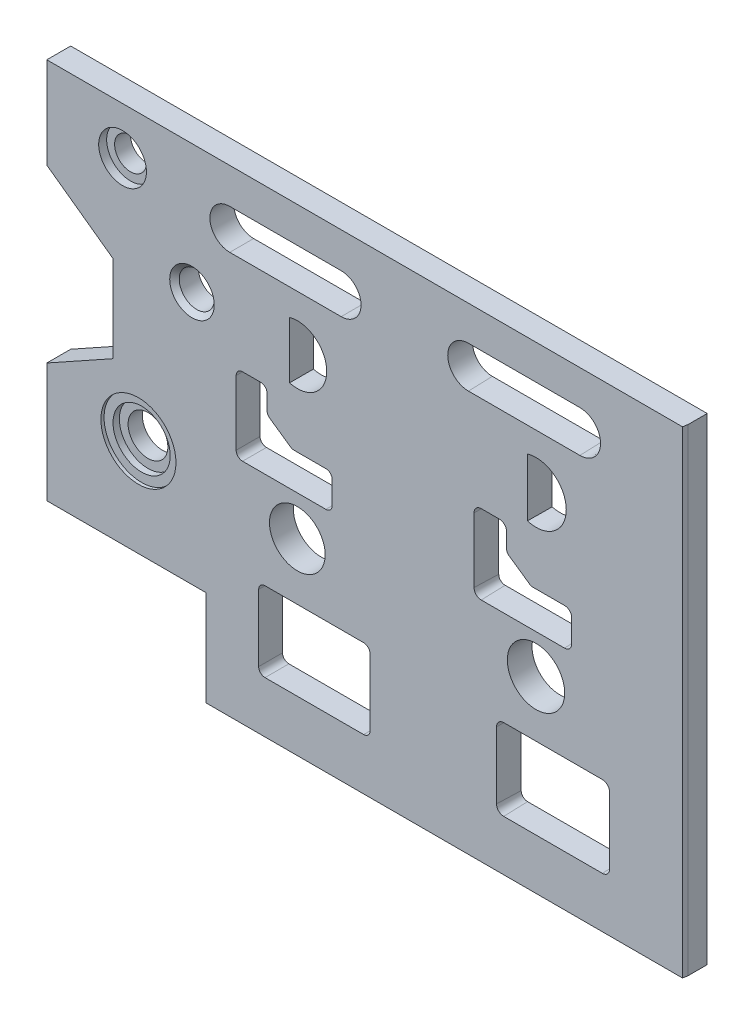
SolidWorks part; units mm, degrees
ref_plane "Front" through (0, 0, 0) normal (0, 0, 1) x (1, 0, 0)
ref_plane "Top" through (0, 0, 0) normal (0, 1, 0) x (1, 0, 0)
ref_plane "Right" through (0, 0, 0) normal (1, 0, 0) x (0, 0, -1)
sketch "Sketch1" plane through (0, 0, 0) normal (0, 0, 1) x (1, 0, 0)
  line L1 (0, 0) -> (400, 0)
  line L2 (0, 0) -> (0, 300)
  line L3 (0, 300) -> (400, 300)
  line L4 (400, 0) -> (400, 300)
  dimension "D1" = 400
  dimension "D2" = 300
extrude "Base-Extrude" add sketch "Sketch1" along normal blind 15
sketch "Sketch3" plane through (0, 0, 0) normal (0, 0, -1) x (-1, 0, 0)
  line L0 (0, 134.9765) -> (-41.6275, 158.1377)
  line L1 (0, 0) -> (-100, 0)
  line L3 (0, 60) -> (-100, 60)
  line L4 (-100, 0) -> (-100, 60)
  line L5 (0, 300) -> (0, 0) construction
  line L6 (-41.6275, 158.1377) -> (-41.6275, 212.5978)
  line L7 (-41.6275, 212.5978) -> (0, 242.6448)
  line L8 (0, 242.6448) -> (0, 134.9765)
  line L9 (0, 60) -> (0, 0)
  dimension "D1" = 100
  dimension "D2" = 60
extrude "Cut-Extrude1" cut sketch "Sketch3" against normal blind 15
sketch "Sketch5" plane through (0, 0, 0) normal (0, 0, -1) x (-1, 0, 0)
  line L0 (-119.0047, 187.7042) -> (-119.0047, 147.0156)
  line L1 (-137.1299, 82.3161) -> (-199.1299, 82.3161)
  line L2 (-133.1299, 78.3161) -> (-133.1299, 36.3161)
  line L3 (-137.1299, 32.3161) -> (-199.1299, 32.3161)
  line L4 (-203.1299, 78.3161) -> (-203.1299, 36.3161)
  line L5 (-123.0047, 143.0156) -> (-175.3427, 143.0156)
  line L6 (-179.3427, 147.0156) -> (-179.3427, 161.169)
  line L7 (-175.3427, 165.169) -> (-155.4347, 165.169)
  line L8 (-153.1505, 165.8854) -> (-140.1258, 174.9461)
  line L9 (-138.41, 178.2297) -> (-138.41, 187.7042)
  line L10 (-134.41, 191.7042) -> (-123.0047, 191.7042)
  line L11 (-152.5477, 236.0895) -> (-152.5477, 200.4363)
  line L13 (-114.9765, 277.6995) -> (-184.9765, 277.6995)
  line L15 (-114.9765, 252.6995) -> (-184.9765, 252.6995)
  circle A0 centre (-157.4347, 118.0751) radius 17.5
  arc A1 (-119.0047, 187.7042) -> (-123.0047, 191.7042) centre (-123.0047, 187.7042) ccw
  arc A2 (-119.0047, 147.0156) -> (-123.0047, 143.0156) centre (-123.0047, 147.0156) cw
  arc A3 (-140.1258, 174.9461) -> (-138.41, 178.2297) centre (-142.41, 178.2297) ccw
  arc A4 (-138.41, 187.7042) -> (-134.41, 191.7042) centre (-134.41, 187.7042) cw
  arc A5 (-155.4347, 165.169) -> (-153.1505, 165.8854) centre (-155.4347, 169.169) ccw
  arc A6 (-179.3427, 161.169) -> (-175.3427, 165.169) centre (-175.3427, 161.169) cw
  arc A7 (-175.3427, 143.0156) -> (-179.3427, 147.0156) centre (-175.3427, 147.0156) cw
  arc A8 (-137.1299, 82.3161) -> (-133.1299, 78.3161) centre (-137.1299, 78.3161) cw
  arc A9 (-133.1299, 36.3161) -> (-137.1299, 32.3161) centre (-137.1299, 36.3161) cw
  arc A10 (-199.1299, 32.3161) -> (-203.1299, 36.3161) centre (-199.1299, 36.3161) cw
  arc A11 (-199.1299, 82.3161) -> (-203.1299, 78.3161) centre (-199.1299, 78.3161) ccw
  arc A12 (-152.5477, 236.0895) -> (-152.5477, 200.4363) centre (-157.4347, 218.2629) ccw
  arc A13 (-184.9765, 277.6995) -> (-184.9765, 252.6995) centre (-184.9765, 265.1995) ccw
  arc A14 (-114.9765, 277.6995) -> (-114.9765, 252.6995) centre (-114.9765, 265.1995) cw
  point P29 (-133.1299, 82.3161)
  point P32 (-133.1299, 32.3161)
  point P35 (-203.1299, 32.3161)
  dimension "D3" = 35
  dimension "D4" = 4
  dimension "D5" = 4
  dimension "D1" = 70
  dimension "D2" = 50
  dimension "D6" = 70
  dimension "D7" = 25
sketch "Sketch9" plane through (8.0224, 31.3523, 0) normal (0, 0, -1) x (-1, 0, 0)
  line L12 (-260.9823, 156.3519) -> (-260.9823, 115.6633)
  line L14 (-279.1075, 50.9638) -> (-341.1075, 50.9638)
  line L16 (-275.1075, 46.9638) -> (-275.1075, 4.9638)
  line L17 (-279.1075, 0.9638) -> (-341.1075, 0.9638)
  line L18 (-345.1075, 46.9638) -> (-345.1075, 4.9638)
  line L19 (-264.9823, 111.6633) -> (-317.3204, 111.6633)
  line L20 (-321.3204, 115.6633) -> (-321.3204, 129.8167)
  line L21 (-317.3204, 133.8167) -> (-297.4124, 133.8167)
  line L22 (-295.1281, 134.533) -> (-282.1034, 143.5937)
  line L23 (-280.3876, 146.8773) -> (-280.3876, 156.3519)
  line L24 (-276.3876, 160.3519) -> (-264.9823, 160.3519)
  line L25 (-294.5254, 204.7371) -> (-294.5254, 169.084)
  line L26 (-256.9542, 246.3472) -> (-326.9542, 246.3472)
  line L27 (-256.9542, 221.3472) -> (-326.9542, 221.3472)
  circle A15 centre (-299.4124, 86.7228) radius 17.5
  arc A16 (-260.9823, 156.3519) -> (-264.9823, 160.3519) centre (-264.9823, 156.3519) ccw
  arc A17 (-260.9823, 115.6633) -> (-264.9823, 111.6633) centre (-264.9823, 115.6633) cw
  arc A18 (-282.1034, 143.5937) -> (-280.3876, 146.8773) centre (-284.3876, 146.8773) ccw
  arc A19 (-280.3876, 156.3519) -> (-276.3876, 160.3519) centre (-276.3876, 156.3519) cw
  arc A20 (-297.4124, 133.8167) -> (-295.1281, 134.533) centre (-297.4124, 137.8167) ccw
  arc A21 (-321.3204, 129.8167) -> (-317.3204, 133.8167) centre (-317.3204, 129.8167) cw
  arc A22 (-317.3204, 111.6633) -> (-321.3204, 115.6633) centre (-317.3204, 115.6633) cw
  arc A23 (-279.1075, 50.9638) -> (-275.1075, 46.9638) centre (-279.1075, 46.9638) cw
  arc A24 (-275.1075, 4.9638) -> (-279.1075, 0.9638) centre (-279.1075, 4.9638) cw
  arc A25 (-341.1075, 0.9638) -> (-345.1075, 4.9638) centre (-341.1075, 4.9638) cw
  arc A26 (-341.1075, 50.9638) -> (-345.1075, 46.9638) centre (-341.1075, 46.9638) ccw
  arc A27 (-294.5254, 204.7371) -> (-294.5254, 169.084) centre (-299.4124, 186.9106) ccw
  arc A28 (-326.9542, 246.3472) -> (-326.9542, 221.3472) centre (-326.9542, 233.8472) ccw
  arc A29 (-256.9542, 246.3472) -> (-256.9542, 221.3472) centre (-256.9542, 233.8472) cw
extrude "Cut-Extrude2" cut sketch "Sketch5" against normal blind 15
extrude "Cut-Extrude3" cut sketch "Sketch9" against normal blind 15 draft 2
sketch "Sketch10" plane through (0, 0, 15) normal (0, 0, 1) x (1, 0, 0)
  circle A0 centre (47.5923, 270.3054) radius 10
  circle A1 centre (91.2264, 219.1912) radius 11
  dimension "D1" = 20
  dimension "D2" = 22
extrude "Cut-Extrude4" cut sketch "Sketch10" against normal blind 15
sketch "Sketch11" plane through (0, 0, 15) normal (0, 0, 1) x (1, 0, 0)
  circle A0 centre (57.5658, 121.3262) radius 12.5
  dimension "D1" = 25
extrude "Cut-Extrude5" cut sketch "Sketch11" against normal blind 15
sketch "Sketch12" plane through (0, 0, 15) normal (0, 0, 1) x (1, 0, 0)
  circle A0 centre (47.5923, 270.3054) radius 15
  dimension "D1" = 30
extrude "Cut-Extrude6" cut sketch "Sketch12" against normal blind 5
chamfer "Chamfer1" distance 3 angle 45 1 edges at (102.2264, 219.1912, 15)
sketch "Sketch13" plane through (0, 0, 15) normal (0, 0, 1) x (1, 0, 0)
  circle A0 centre (57.5658, 121.3262) radius 17.9701
extrude "Cut-Extrude7" cut sketch "Sketch13" against normal blind 6
sketch "Sketch14" plane through (0, 0, 15) normal (0, 0, 1) x (1, 0, 0)
  circle A0 centre (57.5658, 121.3262) radius 23.5887
extrude "Cut-Extrude8" cut sketch "Sketch14" against normal blind 2
chamfer "Chamfer2" distance 3 angle 10 1 edges at (400, 150, 15)
sketch "Stock" plane through (0, 0, 15) normal (0, 0, 1) x (1, 0, 0)
  line L10 (100, 0) -> (399.471, 0)
  line L11 (399.471, 0) -> (399.471, 300)
  line L12 (399.471, 300) -> (0, 300)
  line L13 (0, 300) -> (0, 242.6448)
  line L14 (0, 242.6448) -> (41.6275, 212.5978)
  line L15 (41.6275, 212.5978) -> (41.6275, 158.1377)
  line L16 (41.6275, 158.1377) -> (0, 134.9765)
  line L17 (0, 134.9765) -> (0, 60)
  line L18 (0, 60) -> (100, 60)
  line L19 (100, 60) -> (100, 0)
  line L20 (100, 0) -> (399.471, 0)
  line L21 (399.471, 0) -> (399.471, 300)
  line L22 (399.471, 300) -> (0, 300)
  line L23 (0, 300) -> (0, 242.6448)
  line L24 (0, 242.6448) -> (41.6275, 212.5978)
  line L25 (41.6275, 212.5978) -> (41.6275, 158.1377)
  line L26 (41.6275, 158.1377) -> (0, 134.9765)
  line L27 (0, 134.9765) -> (0, 60)
  line L28 (0, 60) -> (100, 60)
  line L29 (100, 60) -> (100, 0)
  dimension "D1" = 0
